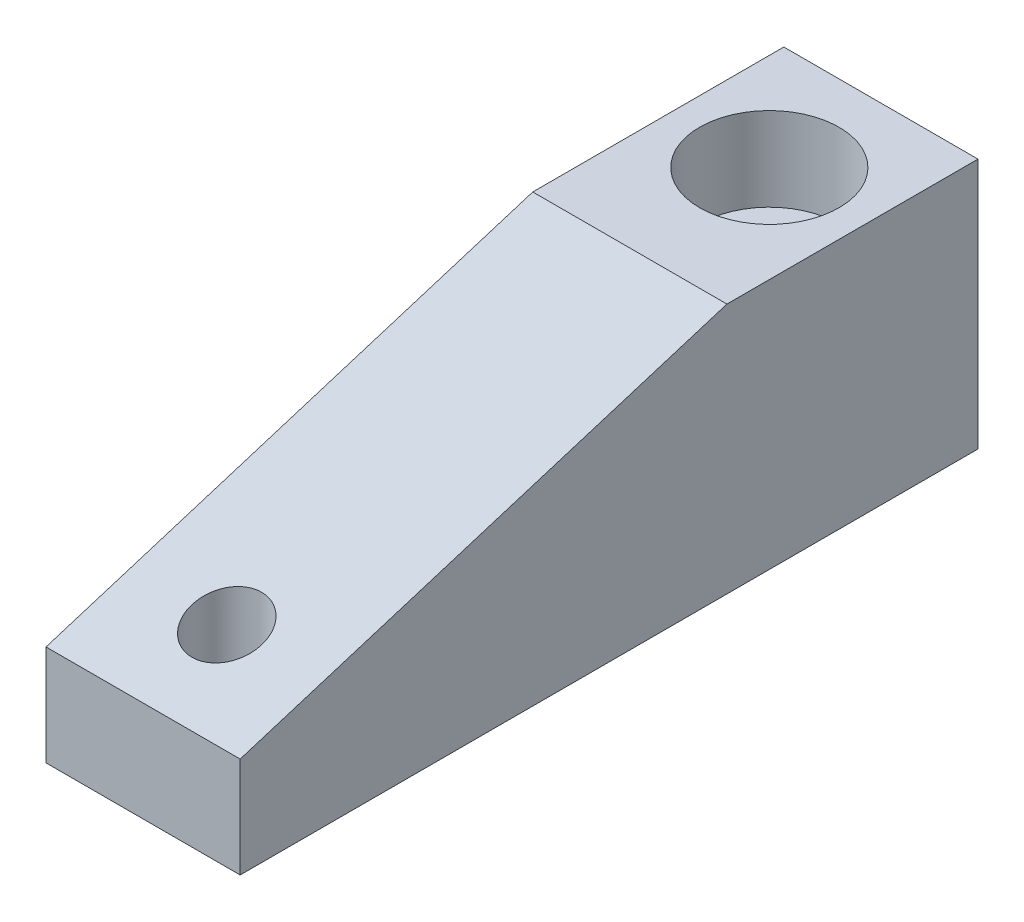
SolidWorks part; units mm, degrees
ref_plane "Front Plane" through (0, 0, 0) normal (0, 0, 1) x (1, 0, 0)
ref_plane "Top Plane" through (0, 0, 0) normal (0, 1, 0) x (1, 0, 0)
ref_plane "Right Plane" through (0, 0, 0) normal (1, 0, 0) x (0, 0, -1)
sketch "Sketch1" plane through (0, 0, 0) normal (0, 1, 0) x (1, 0, 0)
  line L1 (0, 0) -> (22.098, 0)
  line L2 (0, 0) -> (0, -83.9724)
  line L3 (0, -83.9724) -> (22.098, -83.9724)
  line L4 (22.098, 0) -> (22.098, -83.9724)
  dimension "D1" = 22.098
  dimension "D2" = 83.9724
extrude "Extrude1" add sketch "Sketch1" along normal blind 28.575
ref_plane "Plane1" through (11.049, 0, 0) normal (1, 0, 0) x (0, 0, -1)
sketch "Sketch3" plane through (11.049, 0, 0) normal (1, 0, 0) x (0, 0, -1)
  line L0 (-12.7, 31.6794) -> (-12.7, -3.5955) construction
  line L1 (0, 28.575) -> (0, 0) construction
  line L2 (-20.6375, 28.575) -> (-20.6375, 19.05)
  line L3 (-83.9724, 28.575) -> (0, 28.575) construction
  line L4 (-20.6375, 19.05) -> (-17.653, 19.05)
  line L5 (-17.653, 19.05) -> (-17.653, 13.4874)
  line L6 (-17.653, 13.4874) -> (-21.7757, 13.4874)
  line L7 (-21.7757, 13.4874) -> (-22.1996, 0)
  line L8 (-83.9724, 0) -> (0, 0) construction
  line L9 (-22.1996, 0) -> (-12.7, 0)
  line L10 (-12.7, 0) -> (-12.7, 28.575)
  line L11 (-12.7, 28.575) -> (-20.6375, 28.575)
  dimension "D1" = 12.7
  dimension "D2" = 15.875
  dimension "D3" = 9.525
  dimension "D4" = 9.906
  dimension "D5" = 13.4874
  dimension "D6" = 1.8
  dimension "D7" = 18.9992
revolve "Cut-Revolve1" cut sketch "Sketch3" angle 360 about L0
fillet "Fillet1" radius 0.381 1 edges at (11.049, 13.4874, 21.7757)
sketch "Sketch4" plane through (22.098, 0, 0) normal (1, 0, 0) x (0, 0, -1)
  line L0 (-83.9724, 11.43) -> (-83.9724, 28.575)
  line L1 (-83.9724, 28.575) -> (0, 28.575) construction
  line L2 (-83.9724, 28.575) -> (-28.575, 28.575)
  line L3 (-83.9724, 11.43) -> (-28.575, 28.575)
  line L4 (-83.9724, 28.575) -> (-83.9724, 0) construction
  line L6 (-12.7, 19.05) -> (-12.7, 28.575) construction
  line L7 (-83.9724, 0) -> (0, 0) construction
  dimension "D1" = 15.875
  dimension "D2" = 11.43
extrude "Cut-Extrude1" cut sketch "Sketch4" against normal through all
sketch "Sketch5" plane through (0, 0, 0) normal (0, -1, 0) x (1, 0, 0)
  circle A0 centre (11.049, 74.4474) radius 3.9624
  dimension "D1" = 7.9248
  dimension "D2" = 61.7474
extrude "Cut-Extrude2" cut sketch "Sketch5" against normal through all
